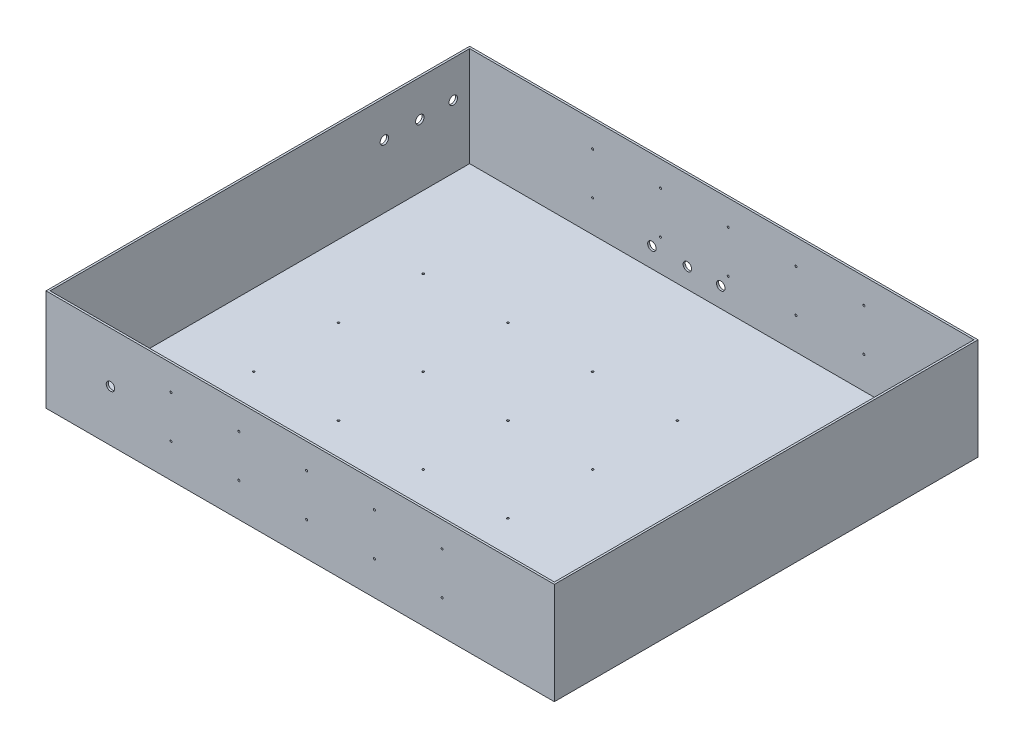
SolidWorks part; units mm, degrees
ref_plane "Front Plane" through (0, 0, 0) normal (0, 0, 1) x (1, 0, 0)
ref_plane "Top Plane" through (0, 0, 0) normal (0, 1, 0) x (1, 0, 0)
ref_plane "Right Plane" through (0, 0, 0) normal (1, 0, 0) x (0, 0, -1)
sketch "Sketch1" plane through (0, 0, 0) normal (0, 1, 0) x (1, 0, 0)
  line L1 (-508, 508) -> (254, 508)
  line L2 (-508, 508) -> (-508, -127)
  line L3 (-508, -127) -> (254, -127)
  line L4 (254, 508) -> (254, -127)
  dimension "D1" = 508
  dimension "D2" = 635
  dimension "D3" = 762
  dimension "D4" = 508
extrude "Extrude1" add sketch "Sketch1" along normal blind 152.4
shell "Shell1" thickness 3.048
sketch "Sketch2" plane through (-3.048, 0, -504.952) normal (0, 0, 1) x (1, 0, 0)
  circle A0 centre (-228.7184, 32.6517) radius 6.35
  circle A1 centre (-175.5384, 32.6517) radius 6.35
  circle A2 centre (-125.4115, 32.6517) radius 6.35
  dimension "D1" = 12.7
extrude "Connector mount--Cut-Extrude1" cut sketch "Sketch2" against normal through all
sketch "Sketch3" plane through (0, 0, -508) normal (0, 0, -1) x (-1, 0, 0)
  line L0 (-250.952, 152.4) -> (-250.952, 3.048) construction
  line L1 (-250.952, 152.4) -> (504.952, 152.4) construction
  circle A0 centre (-85.852, 114.3) radius 1.524
  dimension "D1" = 3.048
  dimension "D3" = 38.1
  dimension "D2" = 165.1
extrude "Clip Mount --Cut-Extrude2" cut sketch "Sketch3" against normal through all
pattern_linear "LPattern2" count 5 spacing 101.6 along (-1, 0, 0) count 2 spacing 63.5 along (0, -1, 0) of "Clip Mount --Cut-Extrude2"
sketch "Sketch4" plane through (0, 0, 127) normal (0, 0, 1) x (1, 0, 0)
  circle A0 centre (-411.3748, 76.774) radius 6.35
  dimension "D1" = 12.7
extrude "Lower Connector Mnt--Cut-Extrude1" cut sketch "Sketch4" against normal up to surface (3.048 mm away)
sketch "Sketch5" plane through (0, 3.048, 0) normal (0, 1, 0) x (-1, 0, 0)
  line L0 (-250.952, 123.952) -> (-250.952, -504.952) construction
  line L1 (-250.952, -504.952) -> (504.952, -504.952) construction
  circle A0 centre (-111.252, -327.152) radius 1.524
  dimension "D1" = 3.048
  dimension "D2" = 139.7
  dimension "D3" = 177.8
extrude "Cut-Extrude1" cut sketch "Sketch5" against normal up to surface (3.048 mm away)
pattern_linear "LPattern4" count 3 spacing 127 along (0, 0, 1) count 5 spacing 127 along (-1, 0, 0) of "Cut-Extrude1"
sketch "Sketch6" plane through (-504.952, 0, 3.048) normal (1, 0, 0) x (0, 0, -1)
  circle A0 centre (380.1818, 97.593) radius 6.35
  circle A1 centre (433.3618, 97.593) radius 6.35
  circle A2 centre (483.4887, 97.593) radius 6.35
  dimension "D1" = 12.7
extrude "Cut-Extrude2" cut sketch "Sketch6" against normal through all
